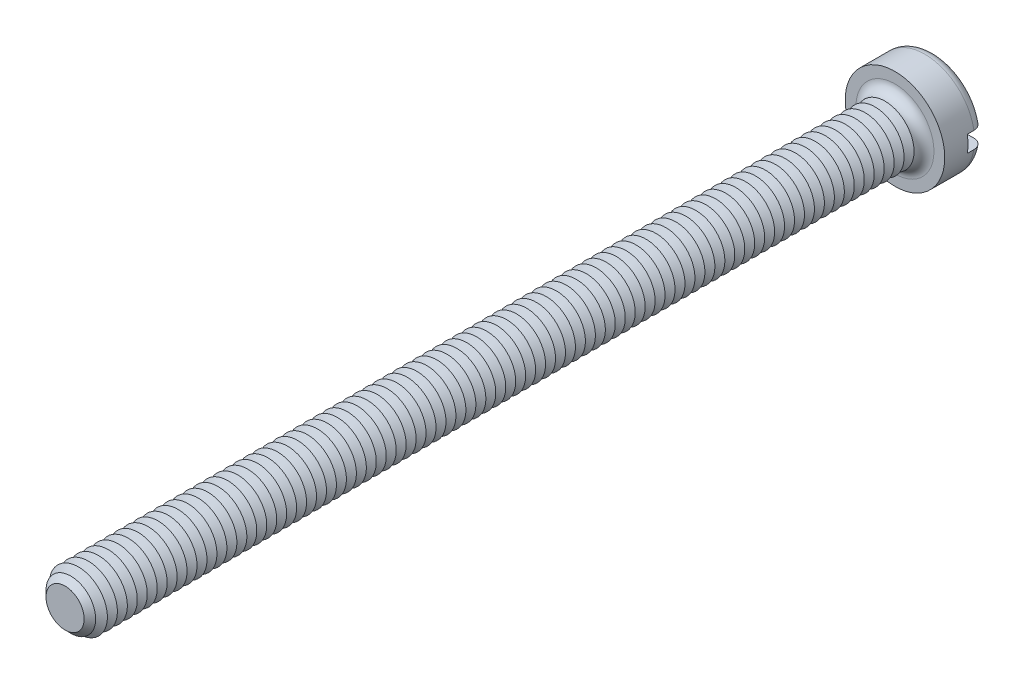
SolidWorks part; units mm, degrees
ref_plane "Front Plane" through (0, 0, 0) normal (0, 0, 1) x (1, 0, 0)
ref_plane "Top Plane" through (0, 0, 0) normal (0, 1, 0) x (1, 0, 0)
ref_plane "Right Plane" through (0, 0, 0) normal (1, 0, 0) x (0, 0, -1)
sketch "Sketch3" plane through (0, 0, 0) normal (0, 0, 1) x (1, 0, 0)
  circle A0 centre (0, 0) radius 3
  dimension "D1" = 6
extrude "Boss-Extrude2" add sketch "Sketch3" against normal blind 2.4
sketch "Sketch4" plane through (0, 0, 0) normal (0, 0, 1) x (1, 0, 0)
  circle A0 centre (0, 0) radius 1.75
  dimension "D1" = 3.5
extrude "Boss-Extrude3" add sketch "Sketch4" along normal blind 50
fillet "Fillet1" radius 0.6 2 edges at (3, 0, -2.4) (1.75, 0, 0)
chamfer "Chamfer1" distance 0.6 angle 45 1 edges at (1.75, 0, 50)
sketch "Sketch5" plane through (0, 0, 0) normal (1, 0, 0) x (0, 0, -1)
  line L0 (1.6944, 0) -> (-7.6738, 0) construction
sketch "Sketch6" plane through (0, 0, 0) normal (1, 0, 0) x (0, 0, -1)
  line L0 (-0.6, 1.75) -> (-0.9, 1.2304)
  line L1 (-0.9, 1.2304) -> (-1.2, 1.75)
  line L2 (-0.6, 1.75) -> (-49.4, 1.75) construction
  line L3 (-1.2, 1.75) -> (-0.6, 1.75)
  dimension "D1" = 0.6
revolve "Cut-Revolve1" cut sketch "Sketch6" angle 360 about L0
pattern_linear "LPattern1" count 82 spacing 0.6 along (0, 0, 1) of "Cut-Revolve1"
sketch "Sketch8" plane through (0, 0, -2.4) normal (0, 0, -1) x (-1, 0, 0)
  line L1 (3, -0.5) -> (-3, -0.5)
  line L2 (3, -0.5) -> (3, 0.5)
  line L3 (3, 0.5) -> (-3, 0.5)
  line L4 (-3, -0.5) -> (-3, 0.5)
  line L5 (3, -0.5) -> (-3, 0.5) construction
  line L6 (3, 0.5) -> (-3, -0.5) construction
  point P0 (0, 0)
  dimension "D1" = 6
  dimension "D2" = 1
extrude "Cut-Extrude1" cut sketch "Sketch8" against normal blind 1
